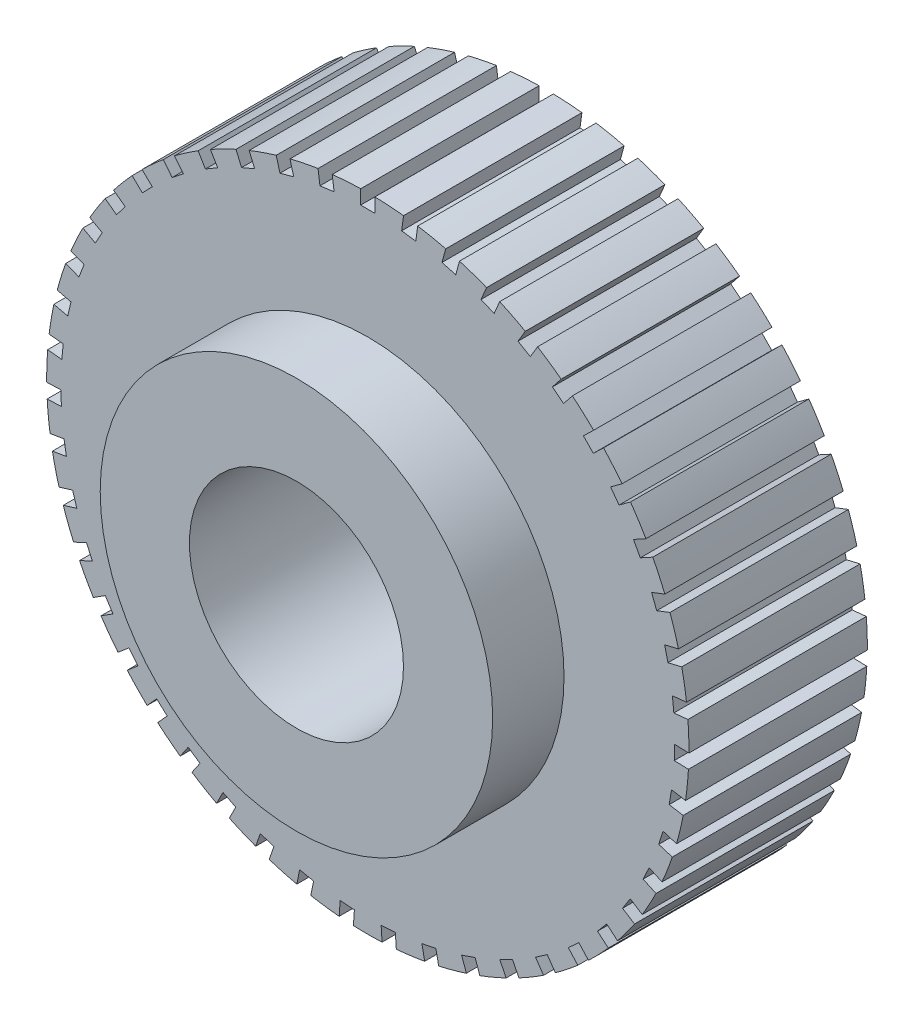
SolidWorks part; units mm, degrees
ref_plane "Plane1" through (0, 0, 0) normal (0, 0, 1) x (1, 0, 0)
ref_plane "Plane2" through (0, 0, 0) normal (0, 1, 0) x (1, 0, 0)
ref_plane "Plane3" through (0, 0, 0) normal (1, 0, 0) x (0, 0, -1)
sketch "Esquisse1" plane through (0, 0, 0) normal (0, 0, 1) x (1, 0, 0)
  circle A0 centre (0, 0) radius 9
  dimension "D1" = 18
extrude "Base-Extrusion" add sketch "Esquisse1" along normal blind 5
sketch "Esquisse2" plane through (0, 0, 5) normal (0, 0, 1) x (1, 0, 0)
  circle A0 centre (0, 0) radius 5.5
  dimension "D1" = 11
extrude "Boss.-Extru.1" add sketch "Esquisse2" along normal blind 2
sketch "Esquisse3" plane through (0, 0, 7) normal (0, 0, 1) x (1, 0, 0)
  circle A0 centre (0, 0) radius 3
  dimension "D1" = 6
extrude "Enlèv. mat.-Extru.1" cut sketch "Esquisse3" against normal blind 12
sketch "Esquisse4" plane through (0, 0, 0) normal (0, 0, -1) x (-1, 0, 0)
  line L0 (0, 0) -> (0, 10) construction
  line L1 (-0.2, 8.8) -> (-0.2, 8.6)
  line L2 (0, 9.2) -> (0.2, 9.2)
  line L3 (0.2, 9.2) -> (0.2, 8.8)
  line L5 (-0.2, 8.8) -> (-0.2, 9.2)
  line L6 (-0.2, 9.2) -> (0, 9.2)
  line L7 (-0.2, 8.6) -> (0.2, 8.6)
  line L8 (0.2, 8.6) -> (0.2, 8.8)
extrude "Enlèv. mat.-Extru.2" cut sketch "Esquisse4" against normal blind 12
pattern_circular "Répétition circulaire1" count 47 every 7.66
